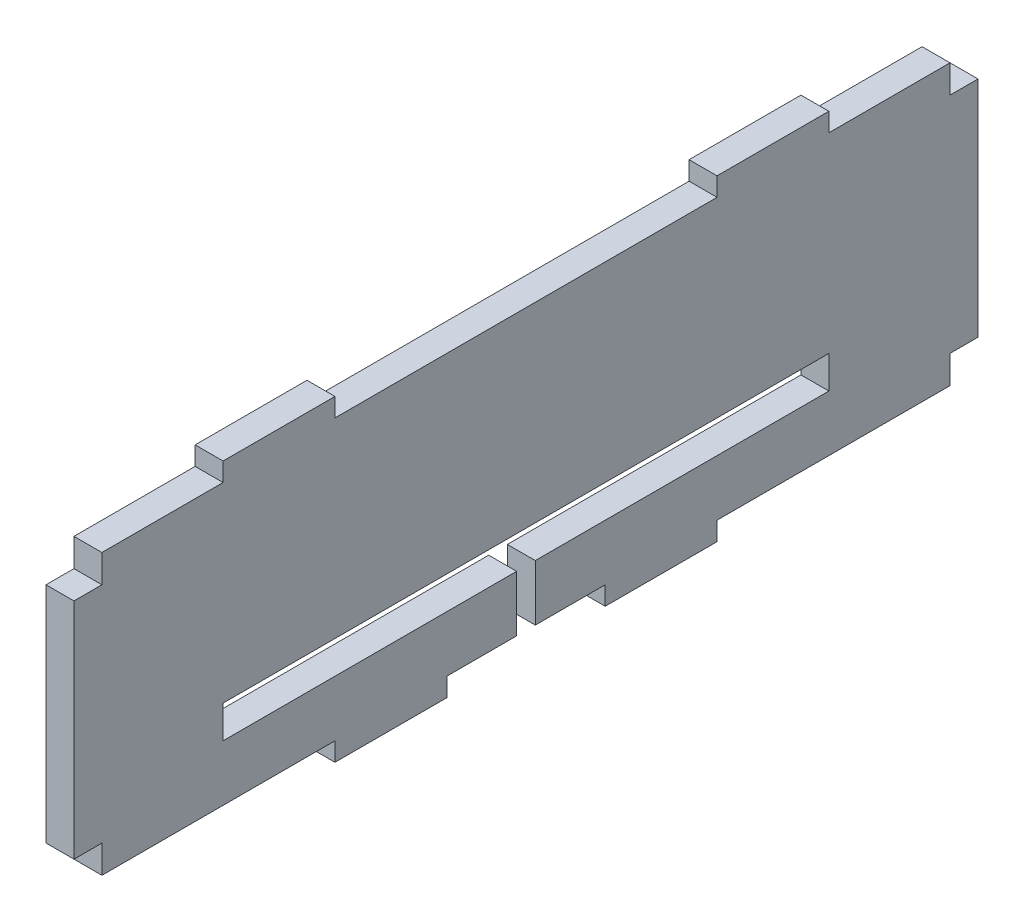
SolidWorks part; units mm, degrees
ref_plane "Front Plane" through (0, 0, 0) normal (0, 0, 1) x (1, 0, 0)
ref_plane "Top Plane" through (0, 0, 0) normal (0, 1, 0) x (1, 0, 0)
ref_plane "Right Plane" through (0, 0, 0) normal (1, 0, 0) x (0, 0, -1)
sketch "Sketch1" plane through (0, 0, 0) normal (1, 0, 0) x (0, 0, -1)
  line L0 (0, 0) -> (0, -32841.5669)
  line L1 (0, 0) -> (32841.5669, 0)
  line L2 (0, 5) -> (3, 5)
  line L3 (0, 0) -> (97, 0)
  line L4 (0, 0) -> (0, 34)
  line L5 (0, 34) -> (97, 34)
  line L6 (97, 0) -> (97, 34)
  line L11 (3, 5) -> (3, 2)
  line L12 (3, 2) -> (28, 2)
  line L13 (28, 2) -> (28, 0)
  line L14 (28, 0) -> (40, 0)
  line L15 (40, 0) -> (40, 2)
  line L16 (16, 8) -> (47.5, 8)
  line L17 (47.5, 8) -> (47.5, 2)
  line L18 (47.5, 2) -> (40, 2)
  line L19 (16, 8) -> (16, 11.5)
  line L20 (16, 11.5) -> (81, 11.5)
  line L21 (81, 11.5) -> (81, 8)
  line L22 (81, 8) -> (49.5, 8)
  line L23 (49.5, 8) -> (49.5, 2)
  line L24 (49.5, 2) -> (57, 2)
  line L25 (57, 2) -> (57, 0)
  line L26 (57, 0) -> (69, 0)
  line L27 (69, 0) -> (69, 2)
  line L28 (69, 2) -> (94, 2)
  line L29 (94, 2) -> (94, 5)
  line L30 (94, 5) -> (97, 5)
  line L31 (0, 29) -> (3, 29)
  line L32 (3, 29) -> (3, 32)
  line L33 (3, 32) -> (16, 32)
  line L34 (16, 32) -> (16, 34)
  line L35 (16, 34) -> (28, 34)
  line L36 (28, 34) -> (28, 32)
  line L37 (28, 32) -> (69, 32)
  line L38 (69, 32) -> (69, 34)
  line L39 (69, 34) -> (81, 34)
  line L40 (81, 34) -> (81, 32)
  line L41 (81, 32) -> (94, 32)
  line L42 (94, 32) -> (94, 29)
  line L43 (94, 29) -> (97, 29)
  dimension "D1" = 34
  dimension "D2" = 97
  dimension "D3" = 2
  dimension "D4" = 3
  dimension "D5" = 3
  dimension "D6" = 2
  dimension "D7" = 12
  dimension "D8" = 17
  dimension "D9" = 3
  dimension "D10" = 3
  dimension "D11" = 12
  dimension "D13" = 12
  dimension "D14" = 2
  dimension "D15" = 2
  dimension "D16" = 12
  dimension "D17" = 2
  dimension "D18" = 3
  dimension "D19" = 5
  dimension "D20" = 3
  dimension "D21" = 12
  dimension "D22" = 12
  dimension "D23" = 3.5
  dimension "D24" = 6
extrude "Boss-Extrude1" add sketch "Sketch1" along normal blind 3 contours L43 L42 L41 L40 L5 L38 L37 L36 L34 L33 L32 L31 L4 L2 L11 L12 L13 L3 L15 L18 L17 L16 L19 L20 L21 L22 L23 L24 L25 L27 L28 L29 L30 L6
